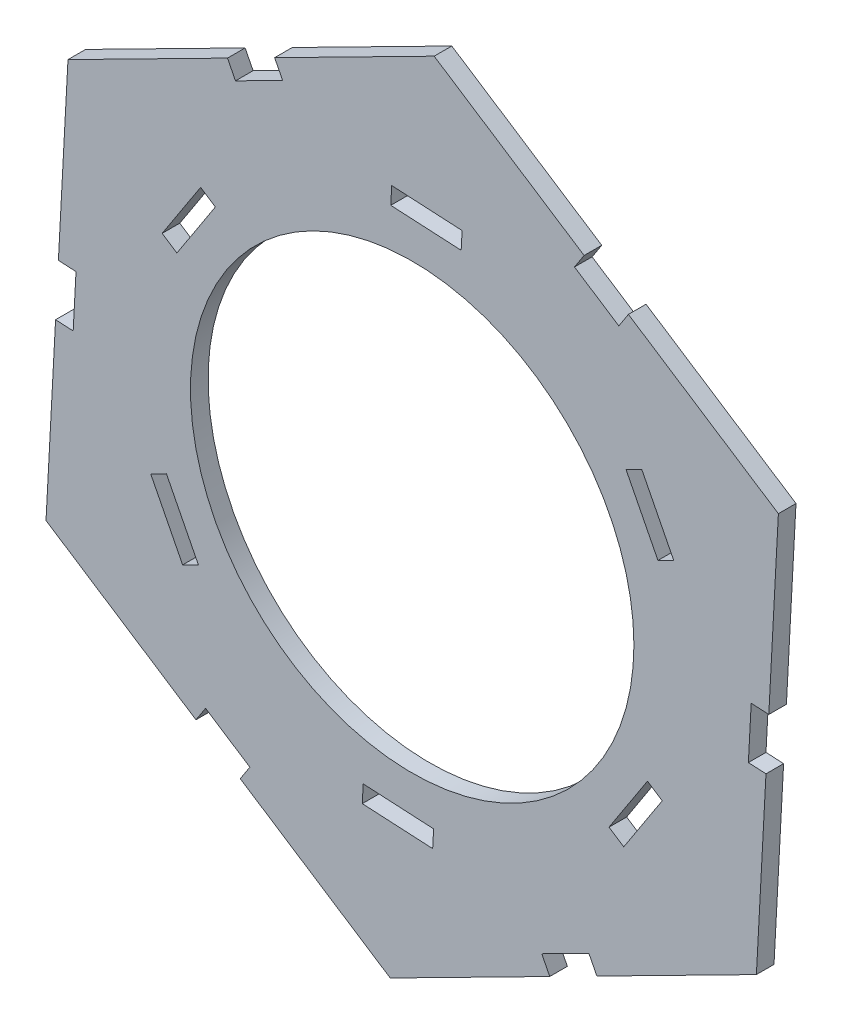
SolidWorks part; units mm, degrees
ref_plane "Front Plane" through (0, 0, 0) normal (0, 0, 1) x (1, 0, 0)
ref_plane "Top Plane" through (0, 0, 0) normal (0, 1, 0) x (1, 0, 0)
ref_plane "Right Plane" through (0, 0, 0) normal (1, 0, 0) x (0, 0, -1)
sketch "Sketch1" plane through (0, 0, 0) normal (0, 0, 1) x (1, 0, 0)
  line L0 (92.7626, 18.286) -> (86.6753, 18.6117)
  line L1 (86.6753, 18.6117) -> (86.7567, 20.1335)
  line L2 (86.7567, 20.1335) -> (92.844, 19.8078)
  line L3 (100.1838, -26.7492) -> (114.2239, -5.1845)
  line L4 (114.2239, -5.1845) -> (102.5684, 17.7569)
  line L5 (102.5684, 17.7569) -> (76.8728, 19.1336)
  line L6 (92.844, 19.8078) -> (92.7626, 18.286)
  line L8 (72.5587, 22.578) -> (58.7651, 15.57)
  line L9 (72.5587, 22.578) -> (73.249, 21.2193)
  line L10 (73.249, 21.2193) -> (77.3251, 23.2902)
  line L11 (76.6348, 24.6489) -> (77.3251, 23.2902)
  line L12 (58.7651, 15.57) -> (57.9374, 0.1204)
  line L13 (62.8327, -2.4311) -> (74.4883, -25.3725)
  line L14 (76.8728, 19.1336) -> (62.8327, -2.4311)
  line L15 (74.4883, -25.3725) -> (100.1838, -26.7492)
  line L16 (109.7793, 3.5721) -> (107.0177, 9.0067)
  line L17 (107.0177, 9.0067) -> (108.3763, 9.6971)
  line L18 (108.3763, 9.6971) -> (111.138, 4.2625)
  line L19 (111.138, 4.2625) -> (109.7793, 3.5721)
  line L20 (105.545, -18.5218) -> (108.8707, -13.4128)
  line L21 (108.8707, -13.4128) -> (110.1479, -14.2443)
  line L22 (110.1479, -14.2443) -> (106.8222, -19.3532)
  line L23 (106.8222, -19.3532) -> (105.545, -18.5218)
  line L24 (84.294, -25.9017) -> (90.3813, -26.2273)
  line L25 (90.3813, -26.2273) -> (90.2999, -27.7491)
  line L26 (90.2999, -27.7491) -> (84.2126, -27.4235)
  line L27 (84.2126, -27.4235) -> (84.294, -25.9017)
  line L28 (67.2773, -11.1877) -> (70.039, -16.6223)
  line L29 (70.039, -16.6223) -> (68.6803, -17.3127)
  line L30 (68.6803, -17.3127) -> (65.9187, -11.8781)
  line L31 (65.9187, -11.8781) -> (67.2773, -11.1877)
  line L32 (71.5116, 10.9061) -> (68.186, 5.7972)
  line L33 (68.186, 5.7972) -> (66.9087, 6.6286)
  line L34 (66.9087, 6.6286) -> (70.2344, 11.7375)
  line L35 (70.2344, 11.7375) -> (71.5116, 10.9061)
  line L36 (57.815, -2.1623) -> (59.3369, -2.2438) construction
  line L37 (57.6927, -4.445) -> (59.2146, -4.5265)
  line L38 (57.9374, 0.1204) -> (59.4592, 0.0389)
  line L39 (90.4284, 31.6568) -> (76.6348, 24.6489)
  line L40 (59.2146, -4.5265) -> (59.4592, 0.0389)
  line L41 (57.6927, -4.445) -> (56.865, -19.8946)
  line L46 (103.3943, 23.2152) -> (90.4284, 31.6568)
  line L47 (103.3943, 23.2152) -> (102.5628, 21.938)
  line L48 (102.5628, 21.938) -> (106.3943, 19.4434)
  line L49 (107.2258, 20.7206) -> (106.3943, 19.4434)
  line L50 (120.1916, 12.279) -> (107.2258, 20.7206)
  line L51 (119.3639, -3.1706) -> (120.1916, 12.279)
  line L52 (119.3639, -3.1706) -> (117.8421, -3.0891)
  line L53 (117.8421, -3.0891) -> (117.5975, -7.6546)
  line L54 (119.1193, -7.7361) -> (117.5975, -7.6546)
  line L55 (118.2915, -23.1857) -> (119.1193, -7.7361)
  line L56 (104.4979, -30.1936) -> (118.2915, -23.1857)
  line L57 (104.4979, -30.1936) -> (103.8076, -28.8349)
  line L58 (103.8076, -28.8349) -> (99.7315, -30.9058)
  line L59 (100.4218, -32.2645) -> (99.7315, -30.9058)
  line L60 (86.6282, -39.2725) -> (100.4218, -32.2645)
  line L61 (73.6624, -30.8308) -> (86.6282, -39.2725)
  line L62 (73.6624, -30.8308) -> (74.4939, -29.5536)
  line L63 (74.4939, -29.5536) -> (70.6624, -27.0591)
  line L64 (69.8309, -28.3362) -> (70.6624, -27.0591)
  line L65 (56.865, -19.8946) -> (69.8309, -28.3362)
  circle A0 centre (88.5283, -3.8078) radius 22.2849 construction
  point P49 (88.5283, -3.8078)
  point P92 (88.5283, -3.8078)
  dimension "D2" = 2.286
  dimension "D3" = 2.286
  dimension "D1" = 6
  dimension "D4" = 6
extrude "Boss-Extrude1" add sketch "Sketch1" along normal blind 1.524
sketch "Sketch2" plane through (0, 0, 1.524) normal (0, 0, 1) x (1, 0, 0)
  circle A0 centre (88.5283, -3.8078) radius 19.1725
extrude "Cut-Extrude1" cut sketch "Sketch2" against normal blind 1.524
